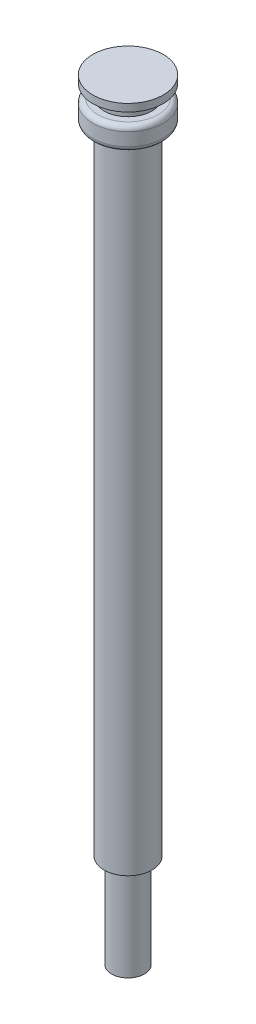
SolidWorks part; units mm, degrees
ref_plane "Front Plane" through (0, 0, 0) normal (0, 0, 1) x (1, 0, 0)
ref_plane "Top Plane" through (0, 0, 0) normal (0, 1, 0) x (1, 0, 0)
ref_plane "Right Plane" through (0, 0, 0) normal (1, 0, 0) x (0, 0, -1)
sketch "Sketch1" plane through (0, 0, 0) normal (0, 0, 1) x (1, 0, 0)
  line L0 (0, 0) -> (0, 88.6018) construction
  line L1 (2.4384, 73.8632) -> (2.4384, 9.525)
  line L2 (2.4384, 73.8632) -> (3.5687, 73.8632)
  line L3 (3.5687, 73.8632) -> (3.5687, 76.2)
  line L4 (3.5687, 76.2) -> (2.4257, 76.2)
  line L5 (2.4257, 76.2) -> (2.4257, 77.4192)
  line L6 (2.4257, 77.4192) -> (3.5687, 77.4192)
  line L7 (3.5687, 77.4192) -> (3.5687, 78.1812)
  line L8 (3.5687, 78.1812) -> (0, 78.1812)
  line L9 (2.4384, 9.525) -> (1.6637, 9.525)
  line L10 (1.6637, 9.525) -> (1.6637, 0)
  line L11 (1.6637, 0) -> (0, 0)
  line L12 (0, 0) -> (0, 78.1812)
  dimension "D1" = 4.8768
  dimension "D2" = 3.3274
  dimension "D3" = 9.525
  dimension "D4" = 66.675
  dimension "D5" = 2.3368
  dimension "D6" = 1.2192
  dimension "D7" = 0.762
  dimension "D8" = 7.1374
  dimension "D9" = 7.1374
  dimension "D10" = 4.8514
revolve "Revolve1" add sketch "Sketch1" angle 360 about L0
fillet "Fillet1" radius 0.508 2 edges at (0, 76.2, -3.5687) (0, 73.8632, -3.5687)
